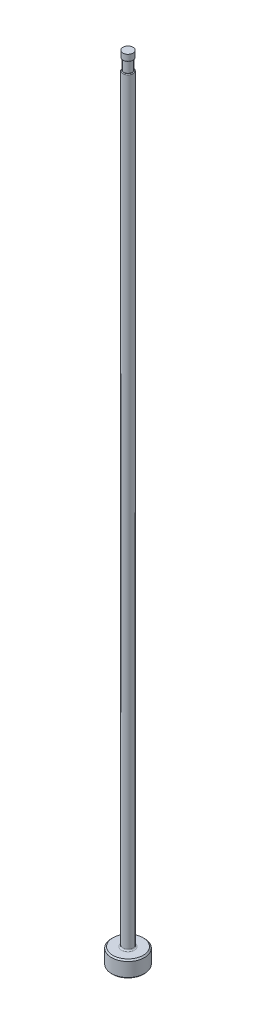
SolidWorks part; units mm, degrees
ref_plane "Front Plane" through (0, 0, 0) normal (0, 0, 1) x (1, 0, 0)
ref_plane "Top Plane" through (0, 0, 0) normal (0, 1, 0) x (1, 0, 0)
ref_plane "Right Plane" through (0, 0, 0) normal (1, 0, 0) x (0, 0, -1)
other "Configuration Table"
sketch "Sketch1" plane through (0, 0, 0) normal (0, 0, 1) x (1, 0, 0)
  line L0 (0, 259.9588) -> (0, -15.1925) construction
  line L1 (0, 0) -> (-3.175, 0)
  line L2 (-3.175, 0) -> (-3.175, 3.175)
  line L3 (-3.175, 3.175) -> (-0.9919, 3.175)
  line L4 (-0.9919, 3.175) -> (-0.9919, 152.4)
  line L5 (-0.9919, 152.4) -> (0, 152.4)
  line L6 (0, 152.4) -> (0, 0)
  dimension "L" = 152.4
  dimension "H" = 6.35
  dimension "T" = 3.175
  dimension "D" = 1.9837
revolve "Revolve1" add sketch "Sketch1" angle 360 about L0
chamfer "Chamfer1" distance 0.254 angle 45 2 edges at (0, 3.175, 3.175) (0, 0, 3.175)
fillet "Fillet1" radius 0.254 1 edges at (0, 3.175, 0.9919)
sketch "Sketch2" plane through (0, 0, 0) normal (0, 0, 1) x (1, 0, 0)
  line L0 (-0.9919, 152.4) -> (-0.9919, 3.429) construction
  line L1 (-0.9919, 151.13) -> (-0.7887, 151.13)
  line L2 (-0.9919, 151.13) -> (-0.9919, 149.098)
  line L3 (-0.9919, 149.098) -> (-0.7887, 149.098)
  line L4 (-0.7887, 151.13) -> (-0.7887, 149.098)
  line L5 (0.9919, 152.4) -> (-0.9919, 152.4) construction
  line L6 (0, 153.4483) -> (0, 147.3282) construction
  dimension "D1" = 2.032
  dimension "N" = 1.27
  dimension "FD" = 0.2032
  dimension "D3" = 1.5773
revolve "Vent Relief" cut sketch "Sketch2" angle 360 about L6
sketch "Sketch3" plane through (0, 0, 0) normal (0, 0, 1) x (1, 0, 0)
  line L0 (-0.7887, 150.114) -> (-0.7887, 86.614)
  line L1 (-0.7887, 151.13) -> (-0.7887, 149.098) construction
  line L2 (-0.9919, 149.098) -> (-0.9919, 3.429) construction
  line L3 (-0.9919, 85.4964) -> (-0.9919, 150.114)
  line L4 (-0.9919, 150.114) -> (-0.7887, 150.114)
  arc A0 (-0.7887, 86.614) -> (-0.9919, 85.4964) centre (-3.9637, 86.614) cw
  dimension "D1" = 3.175
  dimension "D2" = 63.5
extrude "D-Slot" cut sketch "Sketch3" against normal through all both and the other way through all
sketch "Sketch5" plane through (0, 0, 0) normal (0, 0, 1) x (1, 0, 0)
  line L0 (-0.9919, 151.13) -> (0.9919, 151.13) construction
  line L1 (-0.9919, 152.4) -> (-0.9792, 152.4)
  line L2 (-0.9919, 152.4) -> (-0.9919, 151.13)
  line L3 (-0.9919, 151.13) -> (-0.9792, 151.13)
  line L4 (-0.9792, 152.4) -> (-0.9792, 151.13)
  line L5 (0, 152.6877) -> (0, 150.5771) construction
  dimension "VP" = 0.0127
revolve "Vent Diameter" cut sketch "Sketch5" angle 360 about L5
fillet "Fillet2" radius 0.127 2 edges at (0.9919, 149.098, 0) (0, 151.13, 0.9792)
sketch "Pocket Sketch" plane through (0, 0, 0) normal (0, 0, 1) x (1, 0, 0)
  line L0 (-3.5719, 0) -> (-3.5719, 3.2004)
  line L1 (-3.5719, 3.2004) -> (-1.9523, 3.2004)
  line L2 (-1.1903, 3.9624) -> (-1.1903, 22.225)
  line L3 (-1.1903, 22.225) -> (0, 22.225)
  line L4 (0, 22.225) -> (0, 0)
  line L5 (0, 0) -> (-3.5719, 0)
  line L6 (0, 12.6104) -> (0, -2.4989) construction
  line L7 (-3.175, 2.921) -> (-3.175, 0.254) construction
  line L8 (2.921, 3.175) -> (-2.921, 3.175) construction
  line L9 (-0.9919, 85.4964) -> (-0.9919, 3.429) construction
  line L10 (-1.9523, 3.2004) -> (-1.1903, 3.9624)
  point P3 (-1.1903, 3.2004)
  dimension "D1" = 7.1437
  dimension "D2" = 0.3969
  dimension "D3" = 0.0254
  dimension "D4" = 0.1984
  dimension "D5" = 2.3806
  dimension "D6" = 22.225
